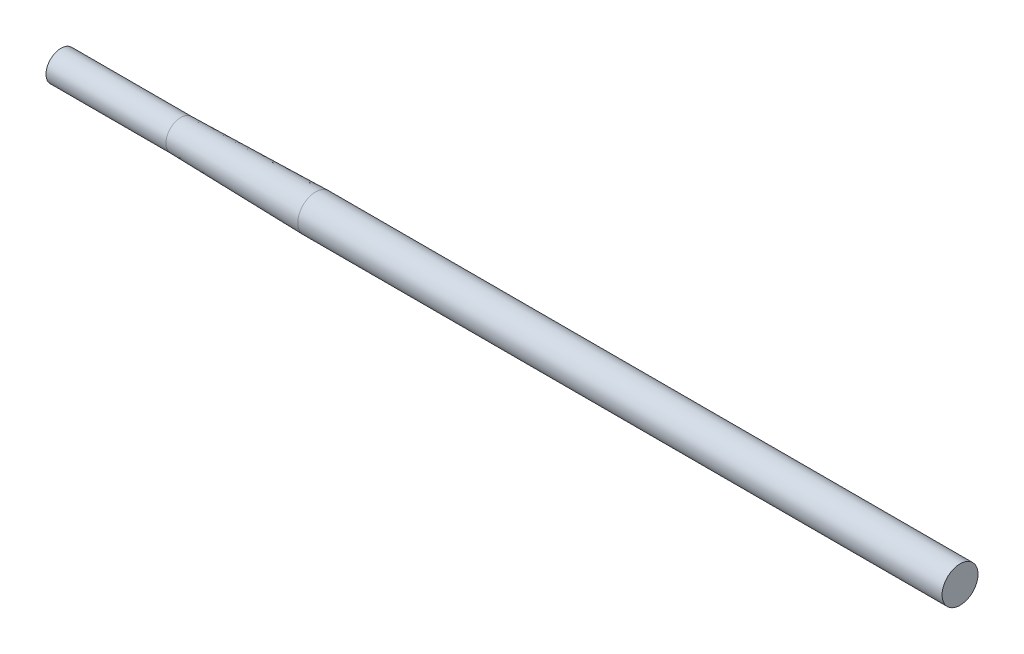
SolidWorks part; units mm, degrees
ref_plane "Front Plane" through (0, 0, 0) normal (0, 0, 1) x (1, 0, 0)
ref_plane "Top Plane" through (0, 0, 0) normal (0, 1, 0) x (1, 0, 0)
ref_plane "Right Plane" through (0, 0, 0) normal (1, 0, 0) x (0, 0, -1)
sketch "Sketch1" plane through (0, 0, 0) normal (0, 0, 1) x (1, 0, 0)
  line L0 (0, 0) -> (300, 0) construction
  line L1 (300, 0) -> (300, 6)
  line L2 (300, 6) -> (85, 6)
  line L3 (85, 6) -> (40, 5)
  line L4 (40, 5) -> (0, 5)
  line L5 (0, 5) -> (0, 0)
  line L6 (0, 0) -> (300, 0)
  dimension "D1" = 300
  dimension "D2" = 12
  dimension "D3" = 10
  dimension "D4" = 40
  dimension "D5" = 215
revolve "Revolve1" add sketch "Sketch1" angle 360 about L0
